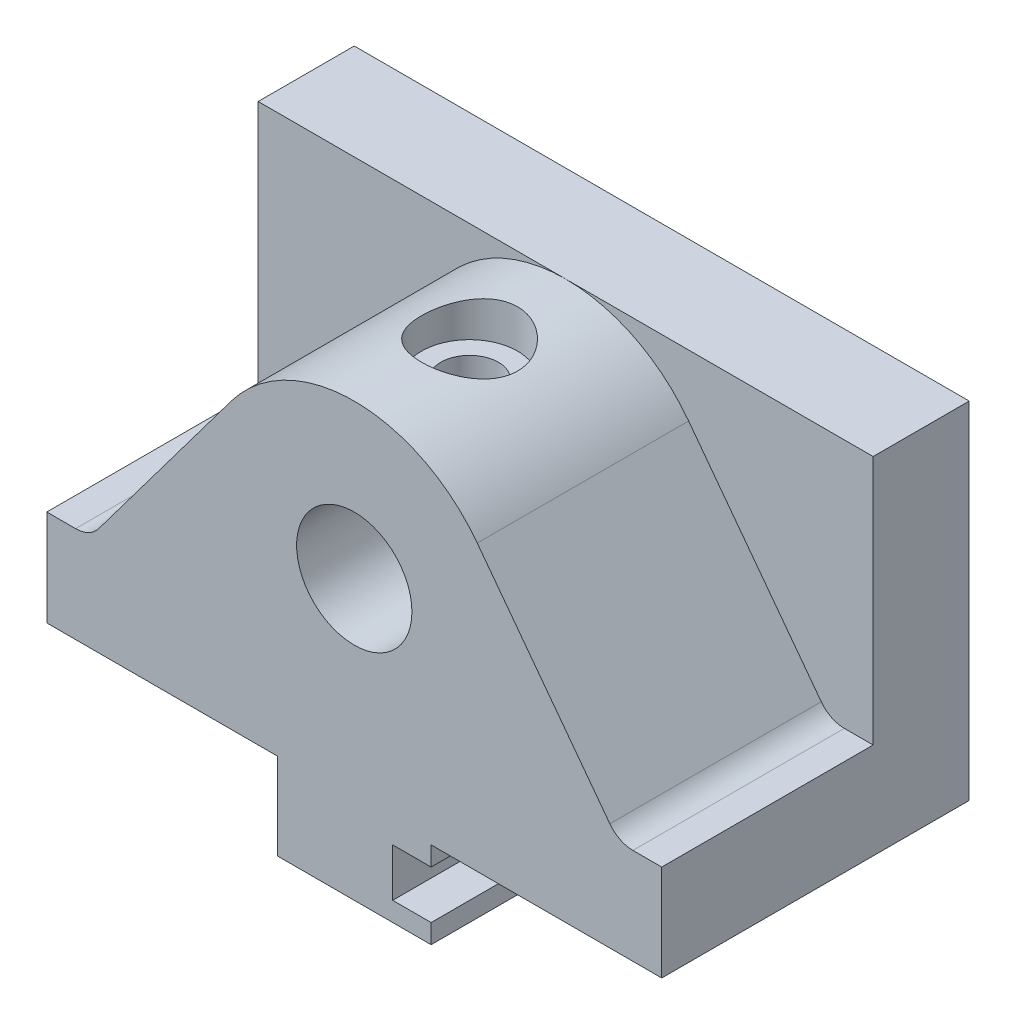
SolidWorks part; units mm, degrees
ref_plane "Front Plane" through (0, 0, 0) normal (0, 0, 1) x (1, 0, 0)
ref_plane "Top Plane" through (0, 0, 0) normal (0, 1, 0) x (1, 0, 0)
ref_plane "Right Plane" through (0, 0, 0) normal (1, 0, 0) x (0, 0, -1)
sketch "Sketch1" plane through (0, 0, 0) normal (0, 0, 1) x (1, 0, 0)
  line L0 (-32, 0) -> (-8, 0)
  line L1 (32, 0) -> (32, 10)
  line L2 (32, 10) -> (27.5, 10)
  line L3 (27.5, 10) -> (12.8, 29.6)
  line L4 (-12.8, 29.6) -> (-27.5, 10)
  line L5 (-27.5, 10) -> (-32, 10)
  line L6 (-32, 10) -> (-32, 0)
  line L7 (-8, 0) -> (-8, -9)
  line L8 (-8, -9) -> (8, -9)
  line L9 (8, -9) -> (8, 0)
  line L10 (8, 0) -> (32, 0)
  line L11 (0, 0) -> (0, -9) construction
  arc A0 (12.8, 29.6) -> (-12.8, 29.6) centre (0, 20) ccw
  point P0 (0, -9)
  dimension "D6" = 16
  dimension "D1" = 16
  dimension "D2" = 55
  dimension "D3" = 64
  dimension "D4" = 9
  dimension "D5" = 10
  dimension "D7" = 20
extrude "Extrude1" add sketch "Sketch1" along normal blind 22
sketch "Sketch2" plane through (0, 0, 0) normal (0, 0, -1) x (-1, 0, 0)
  line L0 (32, 10) -> (32, 0) construction
  line L1 (-32, 0) -> (-8, 0)
  line L2 (-32, 0) -> (-32, 36)
  line L3 (-32, 36) -> (32, 36)
  line L4 (32, 0) -> (32, 36)
  line L5 (-8, 0) -> (-8, -9)
  line L6 (-8, -9) -> (8, -9)
  line L7 (8, -9) -> (8, 0)
  line L8 (8, 0) -> (32, 0)
  arc A0 (12.8, 29.6) -> (-12.8, 29.6) centre (0, 20) ccw construction
extrude "Extrude2" add sketch "Sketch2" along normal blind 10
fillet "Fillet1" radius 3 2 edges at (-27.5, 10, 11) (27.5, 10, 11)
other "Hole1" parameters "D1"=24
sketch "Sketch3" plane through (0, 0, 22) normal (0, 0, 1) x (1, 0, 0)
  circle A0 centre (0, 20) radius 6
  arc A1 (12.8, 29.6) -> (-12.8, 29.6) centre (0, 20) ccw construction
  dimension "D1" = 12
hole_wizard "CBORE for M6 SBHCS1" positions "3DSketch1" profile "Sketch4" counterbore size "M6" standard "Ansi Metric"
sketch3d "3DSketch1"
  line L0 (-32, 36, -10) -> (32, 36, -10) construction
  point P0 (0, 36, 10)
  dimension "D1" = 20
sketch "Sketch4" plane through (0, 36, 10) normal (1, 0, 0) x (0, 0, 1)
  line L0 (0, 0) -> (0, 10)
  line L1 (0, 10) -> (3, 10)
  line L3 (3, 10) -> (3, 4)
  line L4 (3, 4) -> (5, 4)
  line L5 (5, 4) -> (5, 0)
  line L7 (5, 0) -> (0, 0)
  line L11 (0, -6.35) -> (0, 107.95) construction
  dimension "Thru Hole Dia." = 6
  dimension "Thru Hole Depth" = 10
  dimension "C'Bore Dia." = 10
  dimension "C'Bore Depth" = 4
hole_wizard "Ø6.0 (6) Diameter Hole1" positions "3DSketch3" profile "Sketch6" hole size "Ø6.0" standard "Ansi Metric"
sketch3d "3DSketch3"
  line L0 (-8, -9, 22) -> (8, -9, 22) construction
  point P0 (0, -9, 14)
  point P2 (0, -9, -2)
  point P10 (0, -9, 22)
  dimension "D1" = 8
  dimension "D2" = 16
sketch "Sketch6" plane through (0, -9, 14) normal (1, 0, 0) x (0, 0, -1)
  line L0 (0, 0) -> (0, 17.8026)
  line L1 (0, 17.8026) -> (3, 16)
  line L2 (3, 16) -> (3, 0)
  line L5 (3, 0) -> (0, 0)
  line L10 (0, 17.8026) -> (-3, 16) construction
  line L11 (0, -6.35) -> (0, 107.95) construction
  dimension "Hole Dia." = 6
  dimension "Hole Depth" = 16
  dimension "Drill Angle" = 118
sketch "Sketch7" plane through (0, 0, 22) normal (0, 0, 1) x (1, 0, 0)
  line L0 (8, -9) -> (8, 0) construction
  line L1 (8, -2) -> (4, -2)
  line L2 (8, -2) -> (8, -7)
  line L3 (8, -7) -> (4, -7)
  line L4 (4, -2) -> (4, -7)
  line L5 (16, -9) -> (8, -9) construction
  dimension "D1" = 2
  dimension "D2" = 5
  dimension "D3" = 4
extrude "Cut-Extrude1" cut sketch "Sketch7" against normal through all
